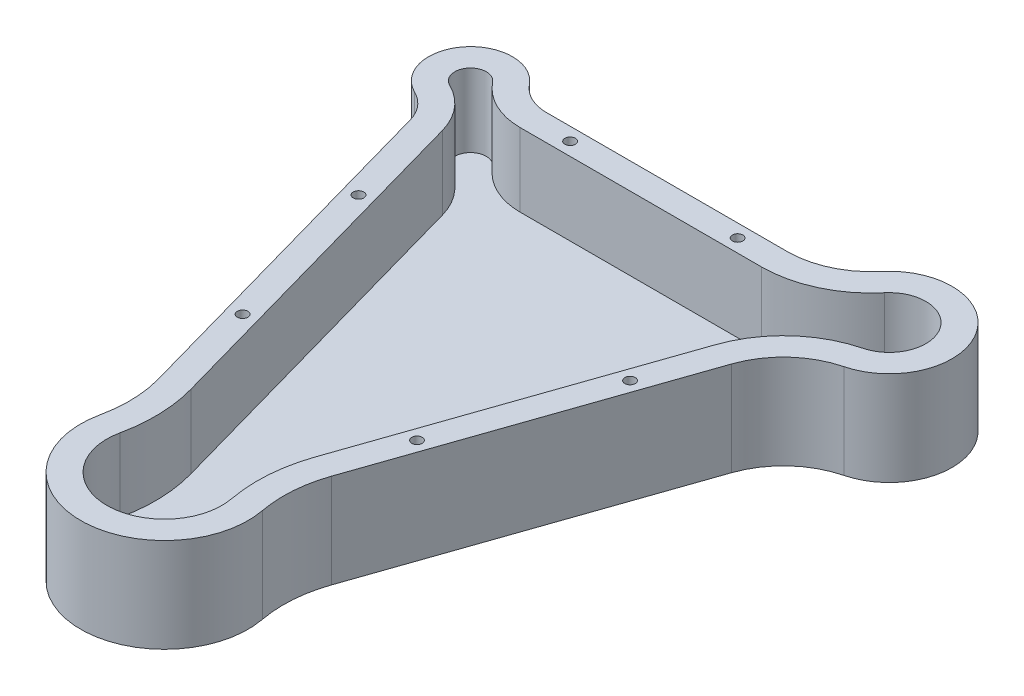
SolidWorks part; units mm, degrees
ref_plane "Front Plane" through (0, 0, 0) normal (0, 0, 1) x (1, 0, 0)
ref_plane "Top Plane" through (0, 0, 0) normal (0, 1, 0) x (1, 0, 0)
ref_plane "Right Plane" through (0, 0, 0) normal (1, 0, 0) x (0, 0, -1)
sketch "Sketch1" plane through (0, 0, 0) normal (0, 1, 0) x (1, 0, 0)
  line L0 (-110.5136, 62.7872) -> (-50.8181, -149.6125)
  line L1 (52.7612, -148.2542) -> (115.1694, 32.0812)
  line L2 (73.124, 107.9638) -> (-73.124, 107.9638)
  line L3 (0, 107.9638) -> (0, -107.9638) construction
  line L4 (-112.7798, 101.6138) -> (141.2202, 101.6138) construction
  line L5 (-44.45, -172.2704) -> (44.45, -172.2704) construction
  arc A0 (-123.873, 78.7643) -> (-92.9519, 117.4888) centre (-112.7798, 101.6138) cw
  arc A1 (150.6298, 64.694) -> (112.0361, 126.1067) centre (141.2202, 101.6138) ccw
  arc A2 (49.9084, -187.3881) -> (-49.6703, -186.2103) centre (0, -196.8638) cw
  arc A3 (-92.9519, 117.4888) -> (-73.124, 107.9638) centre (-73.124, 133.3638) ccw
  arc A4 (-123.873, 78.7643) -> (-110.5136, 62.7872) centre (-134.9662, 55.9148) cw
  arc A5 (112.0361, 126.1067) -> (73.124, 107.9638) centre (73.124, 158.7638) cw
  arc A6 (150.6298, 64.694) -> (115.1694, 32.0812) centre (163.176, 15.4677) ccw
  arc A7 (-49.6703, -186.2103) -> (-50.8181, -149.6125) centre (-124.1758, -170.2299) ccw
  arc A8 (49.9084, -187.3881) -> (52.7612, -148.2542) centre (124.7711, -173.1745) cw
  point P16 (-114.3, 76.2593)
  point P21 (127, 66.267)
  dimension "D1" = 25.4
  dimension "D2" = 38.1
  dimension "D3" = 50.8
  dimension "D8" = 25.4
  dimension "D12" = 50.8
  dimension "D13" = 76.2
  dimension "D4" = 254
  dimension "D5" = 330.2
  dimension "D6" = 88.9
  dimension "D7" = 6.35
  dimension "D9" = 127
  dimension "D10" = 44.45
  dimension "D11" = 114.3
extrude "Extrude1" add sketch "Sketch1" along normal blind 12.7
sketch "Sketch2" plane through (0, 12.7, 0) normal (0, 1, 0) x (-1, 0, 0)
  line L3 (110.5136, -62.7872) -> (50.8181, 149.6125)
  line L4 (-52.7612, 148.2542) -> (-115.1694, -32.0812)
  line L5 (-73.124, -107.9638) -> (73.124, -107.9638)
  line L6 (110.5136, -62.7872) -> (50.8181, 149.6125)
  line L7 (-52.7612, 148.2542) -> (-115.1694, -32.0812)
  line L8 (-73.124, -107.9638) -> (73.124, -107.9638)
  arc A9 (92.9519, -117.4888) -> (73.124, -107.9638) centre (73.124, -133.3638) ccw
  arc A10 (92.9519, -117.4888) -> (123.873, -78.7643) centre (112.7798, -101.6138) ccw
  arc A11 (110.5136, -62.7872) -> (123.873, -78.7643) centre (134.9662, -55.9148) ccw
  arc A12 (49.6703, 186.2103) -> (50.8181, 149.6125) centre (124.1758, 170.2299) ccw
  arc A13 (49.6703, 186.2103) -> (-49.9084, 187.3881) centre (0, 196.8638) ccw
  arc A14 (-52.7612, 148.2542) -> (-49.9084, 187.3881) centre (-124.7711, 173.1745) ccw
  arc A15 (-150.6298, -64.694) -> (-115.1694, -32.0812) centre (-163.176, -15.4677) ccw
  arc A16 (-150.6298, -64.694) -> (-112.0361, -126.1067) centre (-141.2202, -101.6138) ccw
  arc A17 (-73.124, -107.9638) -> (-112.0361, -126.1067) centre (-73.124, -158.7638) ccw
  arc A18 (92.9519, -117.4888) -> (73.124, -107.9638) centre (73.124, -133.3638) ccw
  arc A19 (92.9519, -117.4888) -> (123.873, -78.7643) centre (112.7798, -101.6138) ccw
  arc A20 (110.5136, -62.7872) -> (123.873, -78.7643) centre (134.9662, -55.9148) ccw
  arc A21 (49.6703, 186.2103) -> (50.8181, 149.6125) centre (124.1758, 170.2299) ccw
  arc A22 (49.6703, 186.2103) -> (-49.9084, 187.3881) centre (0, 196.8638) ccw
  arc A23 (-52.7612, 148.2542) -> (-49.9084, 187.3881) centre (-124.7711, 173.1745) ccw
  arc A24 (-150.6298, -64.694) -> (-115.1694, -32.0812) centre (-163.176, -15.4677) ccw
  arc A25 (-150.6298, -64.694) -> (-112.0361, -126.1067) centre (-141.2202, -101.6138) ccw
  arc A26 (-73.124, -107.9638) -> (-112.0361, -126.1067) centre (-73.124, -158.7638) ccw
  dimension "D1" = 0
extrude "Extrude-Thin1" add sketch "Sketch2" along normal blind 44.45 thin
hole_wizard "1/4-28 Tapped Hole1" positions "Sketch4" profile "Sketch3" tap size "1/4-28" standard "Ansi Inch"
sketch "Sketch4" plane through (0, 57.15, 0) normal (0, 1, 0) x (-1, 0, 0)
  line L0 (-93.0778, 7.4841) -> (-59.8508, 103.4972) construction
  line L2 (-37.7591, 143.0625) -> (-100.1673, -37.2729) construction
  line L3 (-52.7612, 148.2542) -> (-115.1694, -32.0812) construction
  line L4 (-50.8, -100.0263) -> (50.8, -100.0263) construction
  line L5 (59.2795, 90.1702) -> (86.7694, -7.6402) construction
  line L7 (110.5136, -62.7872) -> (50.8181, 149.6125) construction
  line L8 (95.2308, -67.0825) -> (35.5352, 145.3172) construction
  line L10 (-73.124, -107.9638) -> (73.124, -107.9638) construction
  line L11 (-73.124, -92.0888) -> (73.124, -92.0888) construction
  line L12 (0, -107.9638) -> (0, -72.4728) construction
  line L13 (-83.9653, 58.0865) -> (-109.795, 67.0253) construction
  line L14 (80.6658, 43.4126) -> (134.7007, 58.5993) construction
  point P1 (50.8, -100.0263)
  point P2 (-50.8, -100.0263)
  point P3 (-93.0778, 7.4841)
  point P4 (-59.8508, 103.4972)
  point P5 (59.2795, 90.1702)
  point P6 (86.7694, -7.6402)
  dimension "D1" = 50.8
  dimension "D2" = 50.8
  dimension "D3" = 50.8
  dimension "D4" = 50.8
  dimension "D5" = 50.8
  dimension "D6" = 50.8
sketch "Sketch3" plane through (-50.8, 57.15, -100.0263) normal (1, 0, 0) x (0, 0, 1)
  line L0 (0, 0) -> (0, 17.0457)
  line L1 (0, 17.0457) -> (2.7051, 15.4203)
  line L2 (2.7051, 15.4203) -> (2.7051, 12.7)
  line L3 (2.7051, 12.7) -> (3.175, 12.7)
  line L4 (3.175, 12.7) -> (3.175, 0)
  line L5 (3.175, 0) -> (0, 0)
  line L10 (0, 17.0457) -> (-2.7051, 15.4203) construction
  line L11 (0, -6.35) -> (0, 107.95) construction
  dimension "Tap Drill Dia." = 5.4102
  dimension "Tap Drill Depth" = 15.4203
  dimension "Thread Major Dia." = 6.35
  dimension "Thread Depth" = 12.7
  dimension "Drill Angle" = 118
